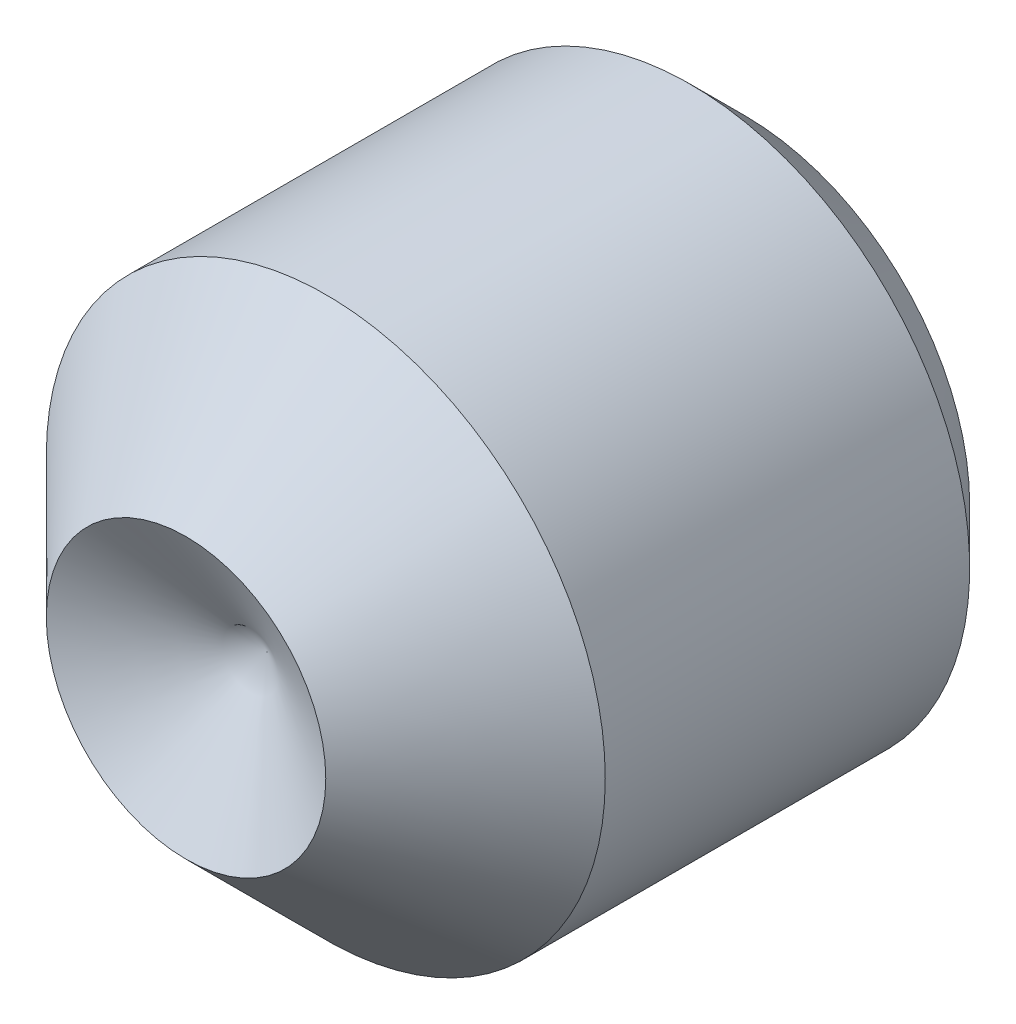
SolidWorks part; units mm, degrees
ref_plane "Front" through (0, 0, 0) normal (0, 0, 1) x (1, 0, 0)
ref_plane "Top" through (0, 0, 0) normal (0, 1, 0) x (1, 0, 0)
ref_plane "Right" through (0, 0, 0) normal (1, 0, 0) x (0, 0, -1)
sketch "Logo3_Revol_Axis" plane through (0, 0, 0) normal (0, 1, 0) x (1, 0, 0)
  line L0 (0, -43.5172) -> (0, 43.5172) construction
sketch "Logo3_bib1" plane through (0, 0, 0) normal (0, -1, 0) x (-1, 0, 0)
  line L0 (0, -6.35) -> (0, 0)
  line L1 (0, -6.35) -> (5, -6.35) construction
  line L2 (1.2446, 0) -> (1.2446, -6.35) construction
  line L3 (0, 0) -> (2.5527, 0)
  line L4 (3.175, -0.6223) -> (3.175, -5.7277)
  line L5 (1.2446, 0) -> (0, -1.2446) construction
  line L6 (0.6223, -0.6223) -> (3.175, -0.6223) construction
  line L7 (3.175, -0.6223) -> (2.5527, 0) construction
  line L8 (2.5527, 0) -> (3.175, -0.6223)
  line L9 (2.5527, 0) -> (2.5527, -6.35) construction
  line L10 (0, 10.5852) -> (0, -63.2873) construction
  line L11 (2.5527, -6.35) -> (3.175, -5.7277) construction
  line L12 (2.5527, -6.35) -> (0, -6.35)
  line L13 (3.175, -5.7277) -> (2.5527, -6.35)
revolve "Revolve1" add sketch "Logo3_bib1" angle 360 about L10
sketch "Logo3_bib11" plane through (0, 0, 0) normal (0, 0, -1) x (1, 0, 0)
  line L1 (1.8331, 0) -> (0.9165, 1.5875)
  line L2 (0.9165, 1.5875) -> (-0.9165, 1.5875)
  line L3 (-0.9165, 1.5875) -> (-1.8331, 0)
  line L4 (-1.8331, 0) -> (-0.9165, -1.5875)
  line L5 (-0.9165, -1.5875) -> (0.9165, -1.5875)
  line L6 (0.9165, -1.5875) -> (1.8331, 0)
  circle A0 centre (0, 0) radius 1.5875 construction
  dimension "Logo3_key" = 3.175
extrude "Cut-Extrude1" cut sketch "Logo3_bib11" against normal blind 2.5
sketch "Logo3_bib2" [suppressed] plane through (0, 0, 0) normal (0, 1, 0) x (1, 0, 0)
  line L0 (-3.1431, -30) -> (-3.1431, 0) construction
  line L1 (-4, -30) -> (0, -30) construction
  line L2 (0, 0) -> (-4, 0) construction
  line L3 (0, -43.5172) -> (0, 43.5172) construction
  line L4 (-5, -29) -> (0, -29) construction
  line L5 (-3.1431, -29) -> (-0.7675, -30)
  line L6 (0, -26.2867) -> (-4, -26.2867) construction
  line L11 (-4, 0) -> (-4, -30) construction
  line L12 (-4, -26.2867) -> (-5, -24.6806) construction
  line L13 (-5, -1) -> (-5, -29) construction
  line L15 (-5, -24.6806) -> (-7, -24.6806)
  line L16 (-7, -24.6806) -> (-7, -32.5)
  line L17 (-7, -32.5) -> (-0.7675, -32.5)
  line L18 (-5, -24.6806) -> (-4, -26.2867)
  line L19 (-4, -26.2867) -> (-3.1431, -26.2867)
  line L20 (-3.1431, -26.2867) -> (-3.1431, -29)
  line L21 (-0.7675, -30) -> (-0.7675, -32.5)
  line L22 (0, 0) -> (0, -32.5) construction
  dimension "D1" = 22.828
  dimension "D2" = 58.093
  dimension "D3" = 2
  dimension "logo3_d2" = 12
  dimension "logo3_l2" = 3.7133
  dimension "D4" = 2.5
revolve "Type2" [suppressed] cut sketch "Logo3_bib2" angle 360 about L0
sketch "Logo3_bib3" plane through (0, 0, 0) normal (0, 1, 0) x (1, 0, 0)
  line L0 (0, 0) -> (0, -6.35) construction
  line L1 (0, -6.35) -> (-5, -6.35) construction
  line L2 (1.5875, -6.35) -> (1.5875, -7.35) construction
  line L4 (-1.5875, -6.35) -> (-3.175, -4.7625)
  line L5 (-3.175, -0.6223) -> (-3.175, -5.7277) construction
  line L6 (-3.175, -4.7625) -> (-4.175, -4.7625)
  line L7 (-4.175, -4.7625) -> (-4.175, -7.35)
  line L8 (-4.175, -7.35) -> (0, -7.35)
  line L9 (0, 10.5852) -> (0, -63.2873) construction
  line L10 (-1.5875, -6.35) -> (0, -5.4335)
  line L12 (0, -5.4335) -> (0, -7.35)
  line L13 (-1.5875, -6.35) -> (-1.5875, -7.35) construction
  dimension "D1" = 30
  dimension "logo3_d2" = 3.175
  dimension "D2" = 45
  dimension "D3" = 1
  dimension "D4" = 1
revolve "Type3" cut sketch "Logo3_bib3" angle 360 about L0
sketch "Logo3_bib4" [suppressed] plane through (0, 0, 0) normal (0, 1, 0) x (1, 0, 0)
  line L0 (0, 0) -> (0, -30) construction
  line L1 (-2.9915, 0) -> (-2.9915, -30) construction
  line L2 (0, 0) -> (-4, 0) construction
  line L3 (-4, -30) -> (0, -30) construction
  line L4 (-2.9915, -30) -> (-5, -27.8033)
  line L5 (-5, -1) -> (-5, -29) construction
  line L6 (-5, -27.8033) -> (-7.5117, -27.8033)
  line L7 (-7.5117, -27.8033) -> (-7.5117, -34.0728)
  line L8 (-7.5117, -34.0728) -> (-2.9915, -34.0728)
  line L9 (-2.9915, -34.0728) -> (-2.9915, -30)
  dimension "D1" = 47.562
  dimension "logo3_d2" = 12
  dimension "D2" = 2.5117
  dimension "D3" = 4.0728
revolve "Type4" [suppressed] cut sketch "Logo3_bib4" angle 360 about L0
equation "\"D2@Cosmetic Thread1\" = \"logo3_d1@Logo3_bib1\"-\"logo3_pas@Logo3_bib1\""
